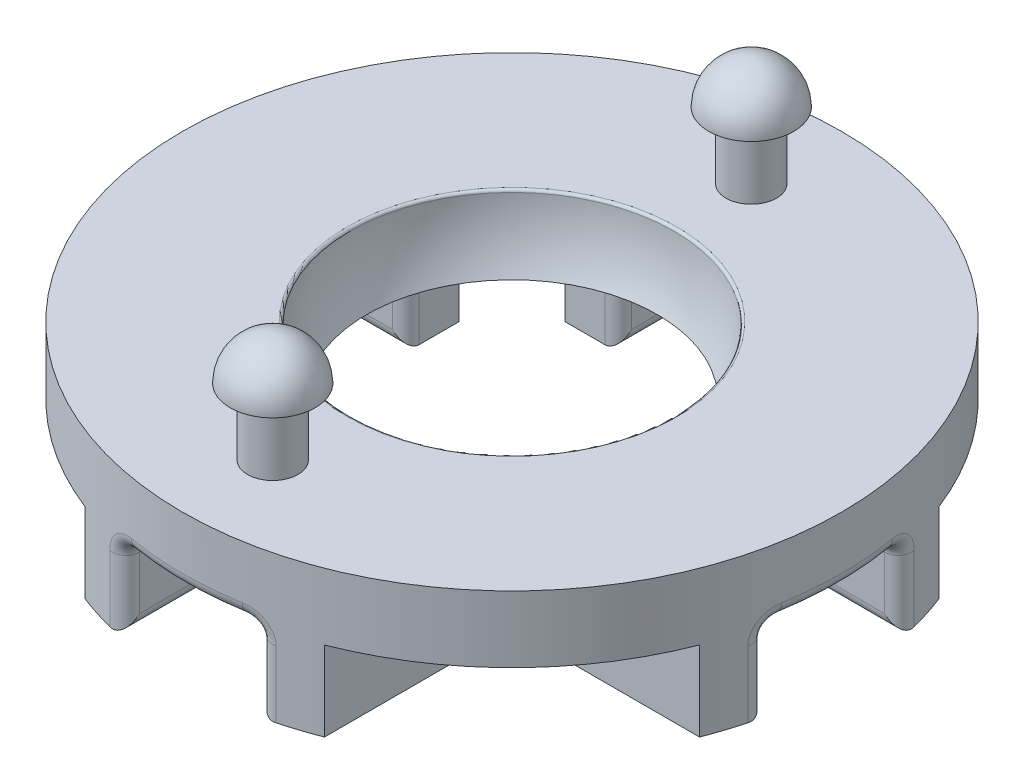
SolidWorks part; units mm, degrees
ref_plane "Front Plane" through (0, 0, 0) normal (0, 0, 1) x (1, 0, 0)
ref_plane "Top Plane" through (0, 0, 0) normal (0, 1, 0) x (1, 0, 0)
ref_plane "Right Plane" through (0, 0, 0) normal (1, 0, 0) x (0, 0, -1)
sketch "Sketch1" plane through (0, 0, 0) normal (0, 0, 1) x (1, 0, 0)
  line L0 (0, 0) -> (0, 4.2142) construction
  line L1 (6.0967, -0.2) -> (12.4, -0.2)
  line L3 (5.4699, -2.7) -> (12.4, -2.7)
  line L4 (12.4, -0.2) -> (12.4, -2.7)
  arc A0 (5.4699, -2.7) -> (6.0967, -0.2) centre (0, 0) ccw
  dimension "D1" = 12.2
  dimension "D2" = 2.5
  dimension "D3" = 0.2
  dimension "D4" = 12.4
revolve "Revolve1" add sketch "Sketch1" angle 360 about L0
sketch "Sketch2" plane through (0, 0, 0) normal (1, 0, 0) x (0, 0, -1)
  line L0 (12.4, -0.2) -> (-12.4, -0.2) construction
  line L1 (-8, -0.2) -> (-5.5, -0.2)
  line L2 (-8, -0.2) -> (-8, -0.4)
  line L3 (-8, -0.4) -> (-5.5, -0.4)
  line L4 (-5.5, -0.2) -> (-5.5, -0.4)
  line L5 (0, 0) -> (0, 3.3874) construction
  line L6 (5.5, -0.2) -> (5.5, -0.4)
  line L7 (8, -0.4) -> (5.5, -0.4)
  line L8 (8, -0.2) -> (8, -0.4)
  line L9 (8, -0.2) -> (5.5, -0.2)
  dimension "D1" = 5.5
  dimension "D2" = 0.2
  dimension "D3" = 2.5
sketch "Sketch3" plane through (0, -0.2, 0) normal (0, 1, 0) x (1, 0, 0)
  line L0 (-6.3862, -5.1833) -> (-3.6098, -2.4069)
ref_plane "Plane1" through (-0.6014, 0, -0.6014) normal (0.7071, 0, 0.7071) x (0.7071, 0, -0.7071)
sketch "Sketch4" plane through (-0.6014, 0, -0.6014) normal (0.7071, 0, 0.7071) x (0.7071, 0, -0.7071)
  line L0 (-8.1809, -0.2) -> (-4.2544, -0.2) construction
  line L1 (-6.5, -0.2) -> (-4, -0.2)
  line L2 (-6.5, -0.2) -> (-6.5, -0.7)
  line L3 (-6.5, -0.7) -> (-4, -0.7)
  line L4 (-4, -0.2) -> (-4, -0.7)
  line L5 (0, 0) -> (0, 3.0786) construction
  line L6 (4, -0.2) -> (4, -0.7)
  line L7 (6.5, -0.7) -> (4, -0.7)
  line L8 (6.5, -0.2) -> (6.5, -0.7)
  line L9 (6.5, -0.2) -> (4, -0.2)
  dimension "D1" = 2.5
  dimension "D2" = 0.5
  dimension "D3" = 4
sketch "Sketch7" plane through (0, -0.2, 0) normal (0, 1, 0) x (1, 0, 0)
  line L0 (0, 0) -> (0, 9) construction
  line L1 (0, 0) -> (0, -9) construction
  line L2 (0, 0) -> (3.5969, 0) construction
  circle A0 centre (0, 0) radius 9 construction
  circle A1 centre (0, 9) radius 0.95
  circle A2 centre (0, -9) radius 0.95
  dimension "D1" = 18
  dimension "D2" = 1.9
  dimension "D3" = 1.9
  dimension "D4" = 90
  dimension "D5" = 90
extrude "Boss-Extrude1" add sketch "Sketch7" along normal blind 2.5
sketch "Sketch8" plane through (0, -2.7, 0) normal (0, -1, 0) x (1, 0, 0)
  line L0 (-12.4, 0) -> (-11, 0) construction
  line L1 (0, 0) -> (0, 3.4976) construction
  line L2 (-4, 11) -> (4, 11)
  line L3 (-4, 11) -> (-4, 10)
  line L4 (-4, 10) -> (-2.75, 10)
  line L7 (-11, -4) -> (-11, 4)
  line L8 (-11, 4) -> (-10, 4)
  line L9 (-10, -4) -> (-10, -2.75)
  line L10 (4, 11) -> (4, 10)
  line L11 (-8.5, 0) -> (8.5, 0) construction
  line L12 (10, -4) -> (10, -2.75)
  line L13 (11, 4) -> (10, 4)
  line L14 (11, -4) -> (11, 4)
  line L15 (4, -11) -> (4, -10)
  line L16 (-4, -10) -> (-2.75, -10)
  line L17 (-4, -11) -> (-4, -10)
  line L18 (-4, -11) -> (4, -11)
  line L19 (11, -4) -> (10, -4)
  line L20 (-11, -4) -> (-10, -4)
  line L37 (2.75, 10) -> (4, 10)
  line L38 (10, 2.75) -> (10, 4)
  line L39 (-10, 2.75) -> (-10, 4)
  line L40 (2.75, -10) -> (4, -10)
  line L41 (-2.75, 10) -> (2.75, 10)
  line L42 (11, 0) -> (12.4, 0) construction
  line L43 (-10, 2.75) -> (-10, -2.75)
  line L44 (10, 2.75) -> (10, -2.75)
  line L45 (2.75, -10) -> (-2.75, -10)
  circle A0 centre (0, 0) radius 12.4 construction
  point P19 (0, 10)
  point P20 (0, 11)
  point P29 (0, -11)
  point P30 (0, -10)
  point P32 (11, 0)
  point P33 (10, 0)
  dimension "D1" = 10
  dimension "D2" = 1
  dimension "D3" = 4
  dimension "D5" = 10
  dimension "D6" = 1
sketch "Sketch9" plane through (0, -2.7, 0) normal (0, -1, 0) x (1, 0, 0)
  line L0 (-2.5, 12.8138) -> (-2.5, 12.1454) construction
  line L1 (-4.5, 12.8138) -> (-2.5, 12.8138) construction
  line L2 (-4.5, 11.5547) -> (-4.5, 6.5)
  line L3 (-4.5, 6.5) -> (-2.5, 6.5)
  line L4 (-2.5, 12.1454) -> (-2.5, 6.5)
  line L5 (2.5, 12.8138) -> (4.5, 12.8138) construction
  line L6 (2.5, 12.1454) -> (2.5, 6.5)
  line L7 (2.5, 6.5) -> (4.5, 6.5)
  line L8 (4.5, 11.5547) -> (4.5, 6.5)
  line L9 (-4.5, 12.8138) -> (-4.5, 11.5547) construction
  line L10 (2.5, 12.8138) -> (2.5, 12.1454) construction
  line L11 (4.5, 12.8138) -> (4.5, 11.5547) construction
  arc A0 (4.5, 11.5547) -> (2.5, 12.1454) centre (0, 0) ccw
  arc A1 (-4.5, 11.5547) -> (4.5, 11.5547) centre (0, 0) ccw construction
  arc A2 (2.5, 12.1454) -> (-2.5, 12.1454) centre (0, 0) ccw construction
  arc A3 (-2.5, 12.1454) -> (-4.5, 11.5547) centre (0, 0) ccw
  dimension "D3" = 24.8
  dimension "D1" = 5
  dimension "D2" = 2.5
  dimension "D4" = 2
  dimension "D5" = 2
  dimension "D6" = 6.5
extrude "Boss-Extrude3" add sketch "Sketch9" along normal blind 3
fillet "Fillet2" radius 0.5 11 edges at (-3.5, -2.7, 6.5) (3.5, -2.7, 6.5) (-2.5, -2.7, 9.3227) (2.5, -2.7, 9.3227) (2.5, -5.7, 9.3227) (-2.5, -5.7, 9.3227) (0, -2.7, 12.4) (2.5, -4.2, 6.5) (2.5, -4.2, 12.1454) (-2.5, -4.2, 6.5) (-2.5, -4.2, 12.1454)
pattern_circular "CirPattern1" count 4 over 360 about axis through (0, 0, 0) along (0, 1, 0) of "Boss-Extrude3", "Fillet2"
fillet "Fillet3" radius 0.1 1 edges at (0, -0.2, -6.0967)
sketch "Sketch10" plane through (0, 0, 0) normal (1, 0, 0) x (0, 0, -1)
  line L0 (-9, 2.3) -> (-9, 3.9)
  line L1 (-8.05, 2.3) -> (-9.95, 2.3) construction
  line L2 (-9, 2.3) -> (-7.4, 2.3)
  line L4 (-9, 5.8834) -> (-9, 5.32) construction
  arc A0 (-7.4, 2.3) -> (-9, 3.9) centre (-9, 2.3) ccw
  dimension "D1" = 1.6
revolve "Revolve2" add sketch "Sketch10" angle 360 about L4
mirror "Mirror1" about plane through (0, 0, 0) normal (0, 0, 1) of "Revolve2"
